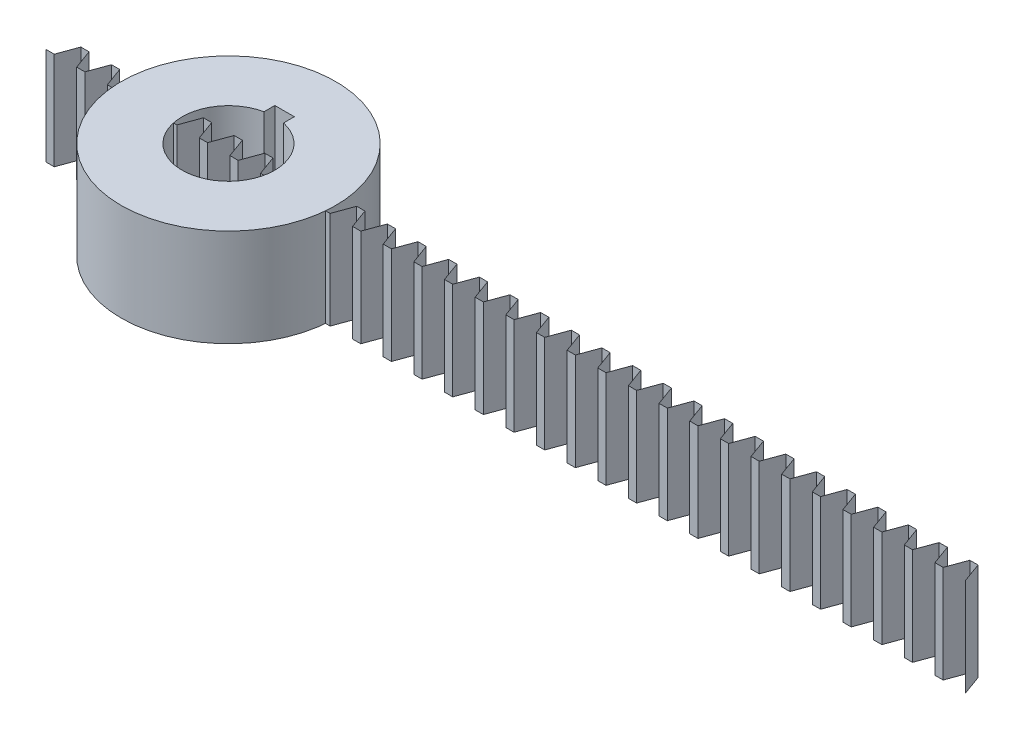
SolidWorks part; units mm, degrees
other "Detailelement1"
ref_plane "Vorne" through (0, 0, 0) normal (0, 0, 1) x (1, 0, 0)
ref_plane "Oben" through (0, 0, 0) normal (0, 1, 0) x (1, 0, 0)
ref_plane "Rechts" through (0, 0, 0) normal (1, 0, 0) x (0, 0, -1)
sketch "Skizze1" plane through (0, 0, 0) normal (0, 1, 0) x (1, 0, 0)
  line L0 (-2, 9.2871) -> (-2, 11.5)
  line L1 (-2, 11.5) -> (2, 11.5)
  line L2 (2, 11.5) -> (2, 9.2871)
  line L3 (0, 0) -> (0, 17.8942) construction
  arc A0 (-2, 9.2871) -> (2, 9.2871) centre (0, 0) ccw
  circle A1 centre (0, 0) radius 22
  dimension "D1" = 19
  dimension "D4" = 44
  dimension "D2" = 4
  dimension "D3" = 2
extrude "Linear austragen1" add sketch "Skizze1" along normal blind 20
sketch "Skizze2" plane through (0, 0, 0) normal (0, -1, 0) x (-1, 0, 0)
  line L0 (29.1172, -2) -> (27.4315, -2)
  line L1 (27.4315, -2) -> (25.9756, 2)
  line L2 (25.9756, 2) -> (24.2899, 2)
  line L3 (24.2899, 2) -> (22.834, -2)
  line L4 (30.5731, 2) -> (29.1172, -2)
  line L5 (32.2588, 2) -> (30.5731, 2)
  line L6 (33.7147, -2) -> (32.2588, 2)
  line L7 (35.4004, -2) -> (33.7147, -2)
  line L8 (-4.3692, 0) -> (36.8144, 0) construction
  line L9 (-11, 0) -> (11, 0) construction
  line L10 (31.4159, 2.9824) -> (31.4159, -2.6477) construction
  line L11 (22.834, -2) -> (21.1483, -2)
  line L12 (21.1483, -2) -> (19.6924, 2)
  line L13 (19.6924, 2) -> (18.0067, 2)
  line L14 (18.0067, 2) -> (16.5508, -2)
  line L15 (16.5508, -2) -> (14.8651, -2)
  line L16 (14.8651, -2) -> (13.4092, 2)
  line L17 (13.4092, 2) -> (11.7235, 2)
  line L18 (11.7235, 2) -> (10.2676, -2)
  line L19 (10.2676, -2) -> (8.5819, -2)
  line L20 (8.5819, -2) -> (7.126, 2)
  line L21 (7.126, 2) -> (5.4403, 2)
  line L22 (5.4403, 2) -> (3.9844, -2)
  line L23 (3.9844, -2) -> (2.2987, -2)
  line L24 (2.2987, -2) -> (0.8429, 2)
  line L25 (0.8429, 2) -> (-0.8429, 2)
  line L26 (-0.8429, 2) -> (-2.2987, -2)
  line L27 (-2.2987, -2) -> (-3.9844, -2)
  line L28 (-3.9844, -2) -> (-5.4403, 2)
  line L29 (-5.4403, 2) -> (-7.126, 2)
  line L30 (-7.126, 2) -> (-8.5819, -2)
  line L31 (-8.5819, -2) -> (-10.2676, -2)
  line L32 (-10.2676, -2) -> (-11.7235, 2)
  line L33 (-11.7235, 2) -> (-13.4092, 2)
  line L34 (-13.4092, 2) -> (-14.8651, -2)
  line L35 (-14.8651, -2) -> (-16.5508, -2)
  line L36 (-16.5508, -2) -> (-18.0067, 2)
  line L37 (-18.0067, 2) -> (-19.6924, 2)
  line L38 (-19.6924, 2) -> (-21.1483, -2)
  line L39 (-21.1483, -2) -> (-22.834, -2)
  line L40 (-22.834, -2) -> (-24.2899, 2)
  line L41 (-24.2899, 2) -> (-25.9756, 2)
  line L42 (-25.9756, 2) -> (-27.4315, -2)
  line L43 (-27.4315, -2) -> (-29.1172, -2)
  line L44 (-29.1172, -2) -> (-30.5731, 2)
  line L45 (-30.5731, 2) -> (-32.2588, 2)
  line L46 (-32.2588, 2) -> (-33.7147, -2)
  line L47 (-33.7147, -2) -> (-35.4004, -2)
  line L48 (-35.4004, -2) -> (-36.8563, 2)
  line L49 (-36.8563, 2) -> (-38.542, 2)
  line L50 (-38.542, 2) -> (-39.9978, -2)
  line L51 (-39.9978, -2) -> (-41.6836, -2)
  line L52 (-41.6836, -2) -> (-43.1394, 2)
  line L53 (-43.1394, 2) -> (-44.8252, 2)
  line L54 (-44.8252, 2) -> (-46.281, -2)
  line L55 (-46.281, -2) -> (-47.9667, -2)
  line L56 (-47.9667, -2) -> (-49.4226, 2)
  line L57 (-49.4226, 2) -> (-51.1083, 2)
  line L58 (-51.1083, 2) -> (-52.5642, -2)
  line L59 (-52.5642, -2) -> (-54.2499, -2)
  line L60 (-54.2499, -2) -> (-55.7058, 2)
  line L61 (-55.7058, 2) -> (-57.3915, 2)
  line L62 (-57.3915, 2) -> (-58.8474, -2)
  line L63 (0, 3.4612) -> (0, -3.3922) construction
  line L64 (0, 11) -> (0, -11) construction
  line L65 (-58.8474, -2) -> (-60.5331, -2)
  line L66 (-60.5331, -2) -> (-61.989, 2)
  line L67 (-61.989, 2) -> (-63.6747, 2)
  line L68 (-63.6747, 2) -> (-65.1306, -2)
  line L69 (-65.1306, -2) -> (-66.8163, -2)
  line L70 (-66.8163, -2) -> (-68.2722, 2)
  line L71 (-68.2722, 2) -> (-69.9579, 2)
  line L72 (-69.9579, 2) -> (-71.4138, -2)
  line L73 (-71.4138, -2) -> (-73.0995, -2)
  line L74 (-73.0995, -2) -> (-74.5554, 2)
  line L75 (-74.5554, 2) -> (-76.2411, 2)
  line L76 (-76.2411, 2) -> (-77.697, -2)
  line L77 (-77.697, -2) -> (-79.3827, -2)
  line L78 (-79.3827, -2) -> (-80.8386, 2)
  line L79 (-80.8386, 2) -> (-82.5243, 2)
  line L80 (-82.5243, 2) -> (-83.9801, -2)
  line L81 (-83.9801, -2) -> (-85.6659, -2)
  line L82 (-85.6659, -2) -> (-87.1217, 2)
  line L83 (-87.1217, 2) -> (-88.8075, 2)
  line L84 (-88.8075, 2) -> (-90.2633, -2)
  line L85 (-90.2633, -2) -> (-91.949, -2)
  line L86 (-91.949, -2) -> (-93.4049, 2)
  line L87 (-93.4049, 2) -> (-95.0906, 2)
  line L88 (-95.0906, 2) -> (-96.5465, -2)
  line L89 (-96.5465, -2) -> (-98.2322, -2)
  line L90 (-98.2322, -2) -> (-99.6881, 2)
  line L91 (-99.6881, 2) -> (-101.3738, 2)
  line L92 (-101.3738, 2) -> (-102.8297, -2)
  line L93 (-102.8297, -2) -> (-104.5154, -2)
  line L94 (-104.5154, -2) -> (-105.9713, 2)
  line L95 (-105.9713, 2) -> (-107.657, 2)
  line L96 (-107.657, 2) -> (-109.1129, -2)
  line L97 (-109.1129, -2) -> (-110.7986, -2)
  line L98 (-110.7986, -2) -> (-112.2545, 2)
  line L99 (-112.2545, 2) -> (-113.9402, 2)
  line L100 (-113.9402, 2) -> (-115.3961, -2)
  line L101 (-115.3961, -2) -> (-117.0818, -2)
  line L102 (-117.0818, -2) -> (-118.5377, 2)
  line L103 (-118.5377, 2) -> (-120.2234, 2)
  line L104 (-120.2234, 2) -> (-121.6793, -2)
  line L105 (-121.6793, -2) -> (-123.365, -2)
  line L106 (-123.365, -2) -> (-124.8209, 2)
  line L107 (-124.8209, 2) -> (-126.5066, 2)
  line L108 (-126.5066, 2) -> (-127.9624, -2)
  line L109 (-127.9624, -2) -> (-129.6482, -2)
  line L110 (-129.6482, -2) -> (-131.104, 2)
  line L111 (-131.104, 2) -> (-132.7897, 2)
  line L112 (-132.7897, 2) -> (-134.2456, -2)
  line L113 (-134.2456, -2) -> (-135.9313, -2)
  line L114 (-135.9313, -2) -> (-137.3872, 2)
  line L115 (-137.3872, 2) -> (-139.0729, 2)
  line L116 (-139.0729, 2) -> (-140.5288, -2)
  line L117 (-140.5288, -2) -> (-142.2145, -2)
  line L118 (-142.2145, -2) -> (-143.6704, 2)
  line L119 (-143.6704, 2) -> (-145.3561, 2)
  line L120 (-145.3561, 2) -> (-146.812, -2)
  line L121 (-146.812, -2) -> (-148.4977, -2)
  line L122 (-148.4977, -2) -> (-149.9536, 2)
  line L123 (-149.9536, 2) -> (-151.6393, 2)
  line L124 (-151.6393, 2) -> (-153.0952, -2)
surface "Oberfläche-Linear austragen1" sketch "Skizze2" parameters "D1"=20
equation "\"D2@Skizze2\"=\"D4@Skizze2\"*Pi"
